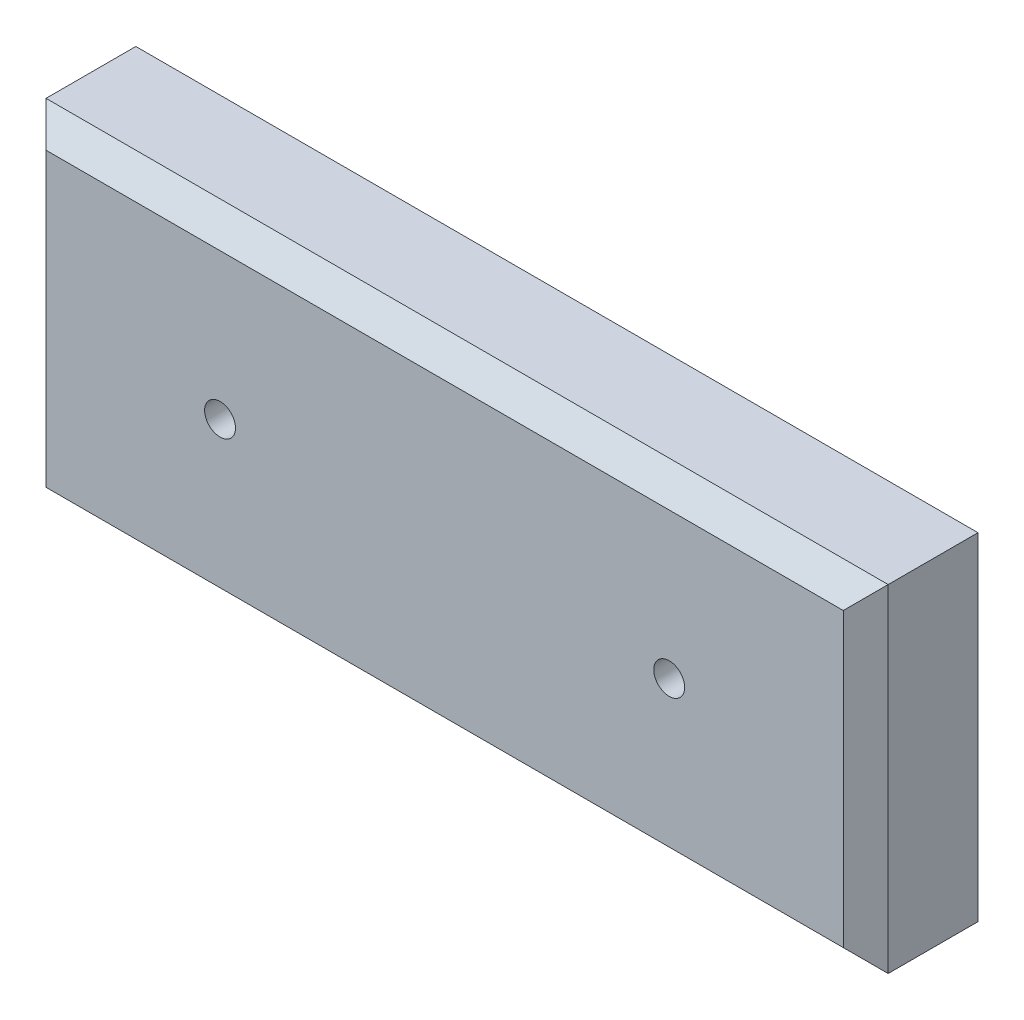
SolidWorks part; units mm, degrees
ref_plane "Frontal" through (0, 0, 0) normal (0, 0, 1) x (1, 0, 0)
ref_plane "Horizontal" through (0, 0, 0) normal (0, 1, 0) x (1, 0, 0)
ref_plane "Vertical" through (0, 0, 0) normal (1, 0, 0) x (0, 0, -1)
sketch "Esquisse1" plane through (0, 0, 0) normal (0, 0, 1) x (1, 0, 0)
  line L0 (-75, -30) -> (-75, 30) construction
  line L1 (-75, 0) -> (75, 0) construction
  line L2 (75, 30) -> (-75, 30) construction
  line L3 (75, -30) -> (75, 30) construction
  line L4 (-75, -30) -> (75, -30) construction
  line L5 (-75, 30) -> (75, 30)
  line L6 (-75, 30) -> (-75, -30)
  line L7 (-75, -30) -> (75, -30)
  line L8 (75, 30) -> (75, -30)
  line L9 (75, 30) -> (-75, -30) construction
  point P7 (0, 0)
  dimension "D1" = 150
  dimension "D2" = 60
extrude "Extrusion1" add sketch "Esquisse1" along normal blind 20
chamfer "Chanfrein1" distance 4 angle 45 4 edges at (0, 30, 20) (-75, 0, 20) (0, -30, 20) (75, 0, 20)
hole_wizard "Chambrage pour vis à tête hexagonale M51" positions "Esquisse3" profile "Esquisse2" counterbore size "M5" standard "ISO"
sketch "Esquisse3" plane through (0, 0, 0) normal (0, 0, -1) x (-1, 0, 0)
  line L0 (-75, 0) -> (68.3785, 0) construction
  line L1 (-75, -30) -> (-75, 30) construction
  point P0 (-40, 0)
  point P1 (40, 0)
  dimension "D1" = 35
  dimension "D2" = 80
sketch "Esquisse2" plane through (40, 0, 0) normal (1, 0, 0) x (0, 1, 0)
  line L0 (0, 0) -> (0, 20)
  line L1 (0, 20) -> (2.75, 20)
  line L3 (2.75, 20) -> (2.75, 5)
  line L4 (2.75, 5) -> (5, 5)
  line L5 (5, 5) -> (5, 0)
  line L7 (5, 0) -> (0, 0)
  line L11 (0, -6.35) -> (0, 107.95) construction
  dimension "Diamètre du perçage jusqu'au prochain" = 5.5
  dimension "Profondeur du perçage jusqu'au prochain" = 20
  dimension "Diamètre du chambrage" = 10
  dimension "Profondeur du chambrage" = 5
